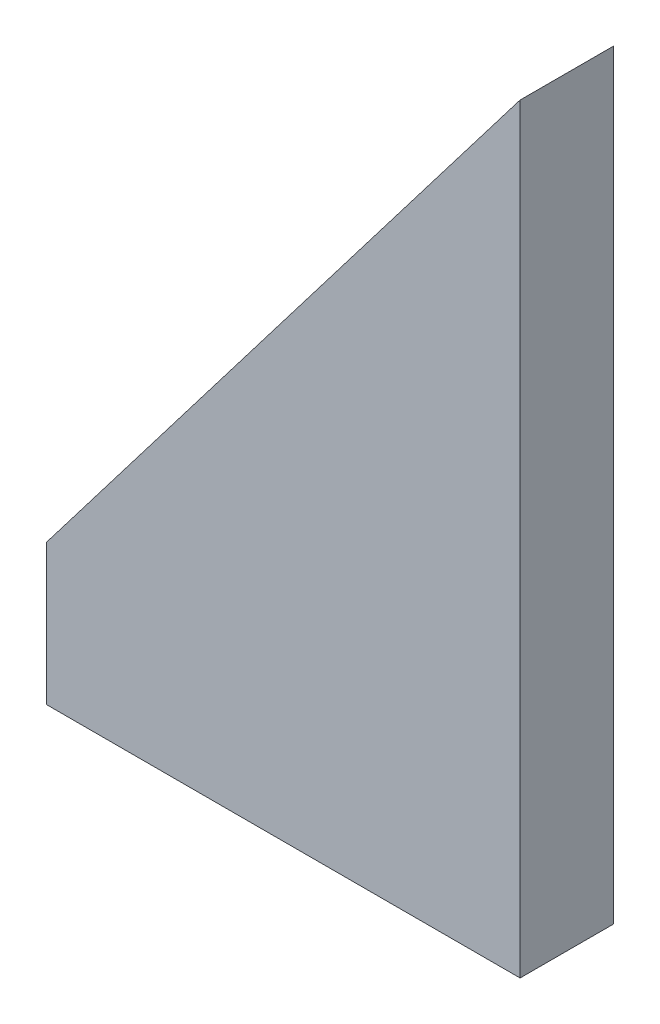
SolidWorks part; units mm, degrees
ref_plane "Plan de face" through (0, 0, 0) normal (0, 0, 1) x (1, 0, 0)
ref_plane "Plan de dessus" through (0, 0, 0) normal (0, 1, 0) x (1, 0, 0)
ref_plane "Plan de droite" through (0, 0, 0) normal (1, 0, 0) x (0, 0, -1)
sketch "Esquisse1" plane through (0, 0, 0) normal (0, 0, 1) x (1, 0, 0)
  line L0 (0, 0) -> (0, 12)
  line L1 (0, 12) -> (40.5, 65)
  line L2 (40.5, 65) -> (40.5, 0)
  line L3 (40.5, 0) -> (0, 0)
  dimension "D1" = 12
  dimension "D2" = 40.5
  dimension "D3" = 65
extrude "Extrusion1" add sketch "Esquisse1" along normal blind 8
